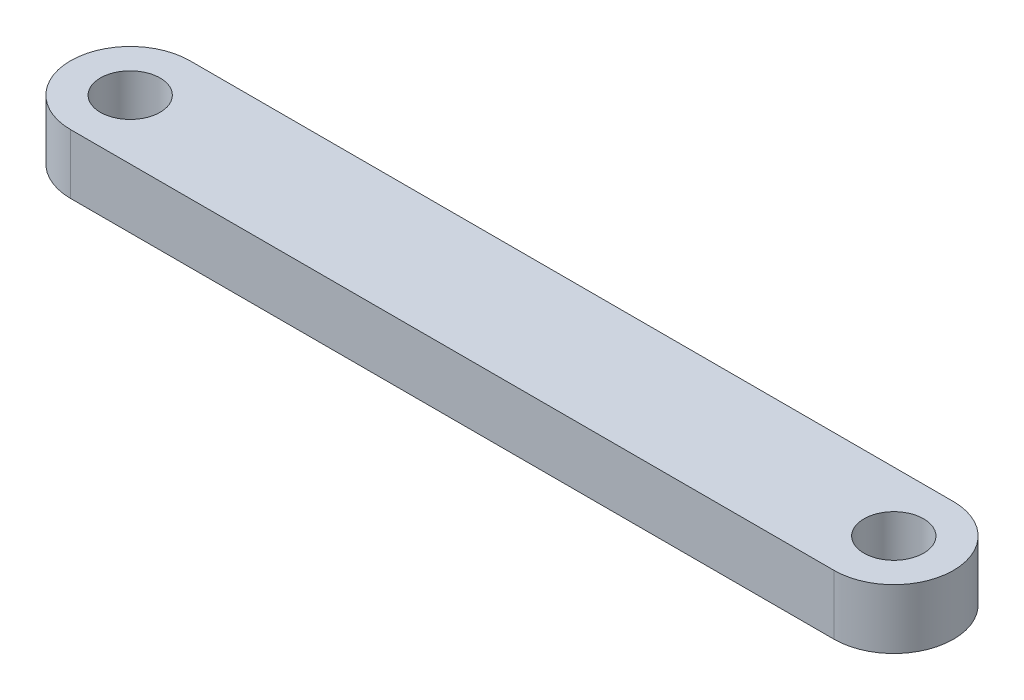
SolidWorks part; units mm, degrees
ref_plane "Front Plane" through (0, 0, 0) normal (0, 0, 1) x (1, 0, 0)
ref_plane "Ali" through (0, 0, 0) normal (0, 1, 0) x (1, 0, 0)
ref_plane "Right Plane" through (0, 0, 0) normal (1, 0, 0) x (0, 0, -1)
sketch "Sketch1" plane through (0, 0, 0) normal (0, 1, 0) x (1, 0, 0)
  line L0 (-640, 0) -> (640, 0) construction
  line L1 (-640, 100) -> (640, 100)
  line L2 (-640, -100) -> (640, -100)
  arc A0 (-640, 100) -> (-640, -100) centre (-640, 0) ccw
  arc A1 (640, -100) -> (640, 100) centre (640, 0) ccw
  circle A2 centre (-640, 0) radius 50
  circle A3 centre (640, 0) radius 50
  point P2 (0, 0)
  dimension "D2" = 100
  dimension "D3" = 100
  dimension "D4" = 100
  dimension "D1" = 1280
extrude "Boss-Extrude1" add sketch "Sketch1" along normal mid plane 100
ref_point "Point1"
